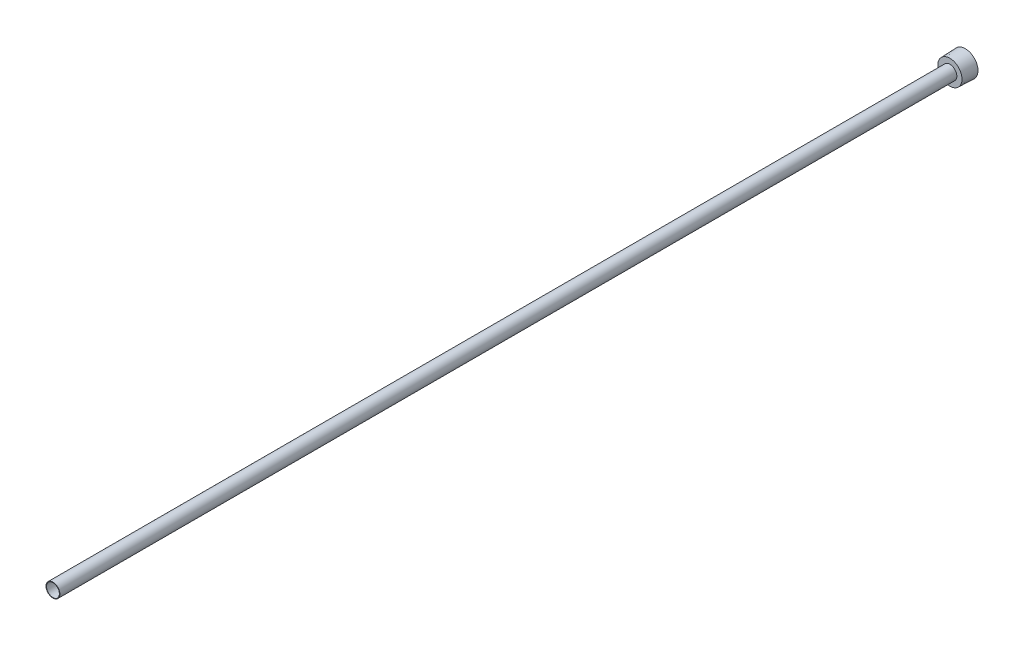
SolidWorks part; units mm, degrees
ref_plane "Front Plane" through (0, 0, 0) normal (0, 0, 1) x (1, 0, 0)
ref_plane "Top Plane" through (0, 0, 0) normal (0, 1, 0) x (1, 0, 0)
ref_plane "Right Plane" through (0, 0, 0) normal (1, 0, 0) x (0, 0, -1)
sketch "Sketch1" plane through (0, 0, 0) normal (1, 0, 0) x (0, 0, -1)
  line L0 (-168.7934, 0) -> (49831.2066, 0) construction
  line L6 (0, 0) -> (0, 8.4709)
  line L7 (0, 8.4709) -> (-10.3124, 8.0947)
  line L8 (-10.3124, 8.0947) -> (-10.3124, 4.6355)
  line L9 (-10.3124, 4.6355) -> (-609.6, 4.6355)
  line L10 (-609.6, 4.6355) -> (-609.6, 0)
  line L11 (0, 0) -> (-609.6, 0)
  dimension "D1" = 10.3124
  dimension "D2" = 16.9418
  dimension "D3" = 2.089
  dimension "D4" = 9.271
  dimension "D5" = 609.6
revolve "Revolve1" add sketch "Sketch1" angle 360 about L0
sketch "Sketch2" plane through (0, 0, 609.6) normal (0, 0, 1) x (1, 0, 0)
  circle A0 centre (0, 0) radius 4.318
  dimension "D1" = 8.636
extrude "Cut-Extrude1" cut sketch "Sketch2" against normal through all
sketch "Sketch3" plane through (0, 0, 0) normal (0, 0, -1) x (-1, 0, 0)
  line L0 (0, 9.318) -> (0, -9.318) construction
  line L1 (-4.7625, -2.7496) -> (0, -5.4993)
  line L2 (0, -5.4993) -> (4.7625, -2.7496)
  line L3 (4.7625, -2.7496) -> (4.7625, 2.7496)
  line L4 (4.7625, 2.7496) -> (0, 5.4993)
  line L5 (0, 5.4993) -> (-4.7625, 2.7496)
  line L6 (-4.7625, 2.7496) -> (-4.7625, -2.7496)
  circle A0 centre (0, 0) radius 4.7625 construction
  dimension "D1" = 9.525
extrude "Cut-Extrude2" cut sketch "Sketch3" against normal blind 6.35
